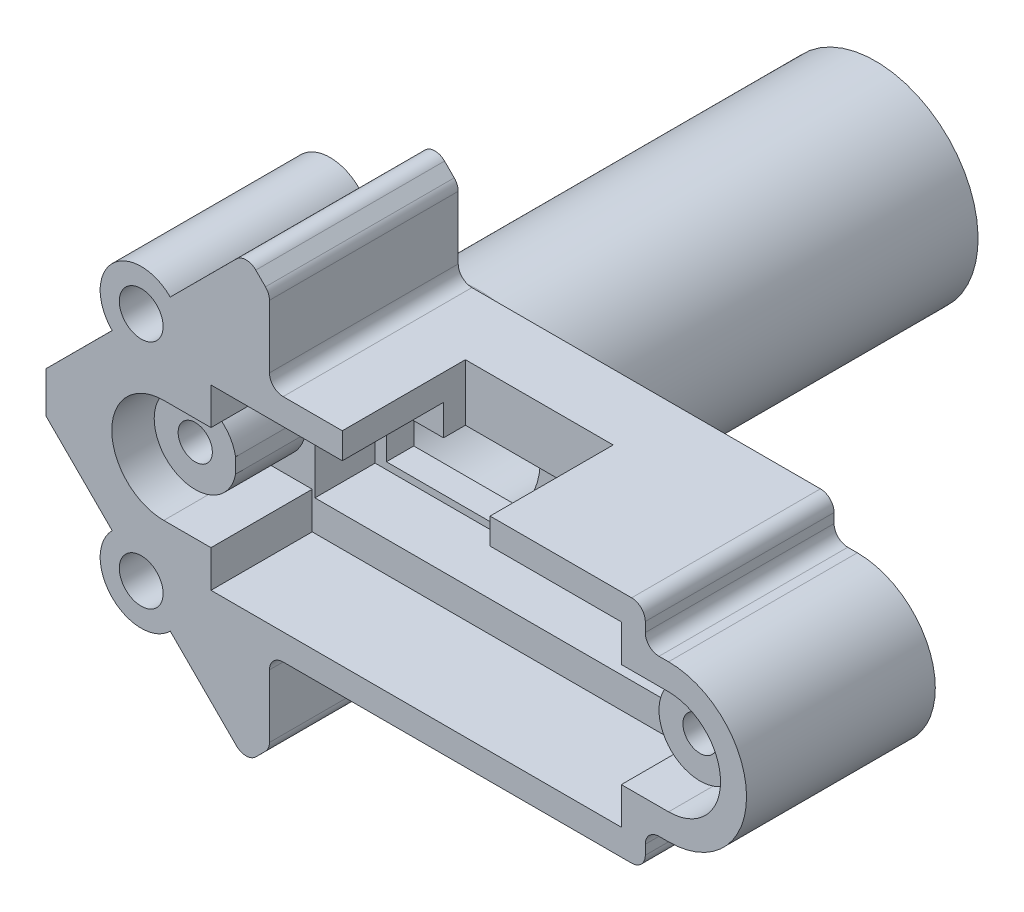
SolidWorks part; units mm, degrees
ref_plane "Ebene vorne" through (0, 0, 0) normal (0, 0, 1) x (1, 0, 0)
ref_plane "Ebene oben" through (0, 0, 0) normal (0, 1, 0) x (1, 0, 0)
ref_plane "Ebene rechts" through (0, 0, 0) normal (1, 0, 0) x (0, 0, -1)
sketch "Skizze1" plane through (0, 0, 0) normal (0, 0, 1) x (1, 0, 0)
  line L0 (0, 0) -> (36.9, 0) construction
  line L1 (0, 3.7) -> (3.7, 3.7) construction
  line L2 (3.7, -6.4) -> (33.2, -6.4) construction
  line L3 (3.7, -6.4) -> (3.7, -3.7) construction
  line L4 (3.7, 6.4) -> (33.2, 6.4) construction
  line L5 (33.2, -6.4) -> (33.2, -3.7) construction
  line L6 (3.7, -6.4) -> (33.2, 6.4) construction
  line L7 (3.7, 6.4) -> (33.2, -6.4) construction
  line L8 (0, -3.7) -> (3.7, -3.7) construction
  line L9 (36.9, 3.7) -> (33.2, 3.7) construction
  line L10 (36.9, -3.7) -> (33.2, -3.7) construction
  line L11 (33.2, 3.7) -> (33.2, 6.4) construction
  line L12 (3.7, 3.7) -> (3.7, 6.4) construction
  line L13 (0, 5.7) -> (1.7, 5.7)
  line L14 (1.7, 5.7) -> (1.7, 8.4)
  line L15 (1.7, 8.4) -> (35.2, 8.4)
  line L16 (35.2, 5.7) -> (35.2, 8.4)
  line L17 (36.9, 5.7) -> (35.2, 5.7)
  line L18 (36.9, -5.7) -> (35.2, -5.7)
  line L19 (35.2, -8.4) -> (35.2, -5.7)
  line L20 (1.7, -8.4) -> (35.2, -8.4)
  line L21 (1.7, -8.4) -> (1.7, -5.7)
  line L22 (0, -5.7) -> (1.7, -5.7)
  arc A0 (0, 3.7) -> (0, -3.7) centre (0, 0) ccw construction
  arc A1 (36.9, -3.7) -> (36.9, 3.7) centre (36.9, 0) ccw construction
  arc A2 (36.9, -5.7) -> (36.9, 5.7) centre (36.9, 0) ccw
  arc A3 (0, 5.7) -> (0, -5.7) centre (0, 0) ccw
  point P5 (18.45, 0)
  dimension "D1" = 7.4
  dimension "D2" = 7.4
  dimension "D3" = 36.9
  dimension "D4" = 12.8
  dimension "D5" = 29.5
  dimension "D6" = 2
extrude "Aufsatz-Linear austragen1" add sketch "Skizze1" along normal blind 13.8
sketch "Skizze2" plane through (0, 0, 13.8) normal (0, 0, 1) x (1, 0, 0)
  line L0 (1.7, 8.4) -> (35.2, -8.4) construction
  line L2 (4.475, -3.75) -> (32.425, -3.75)
  line L3 (4.475, -3.75) -> (4.475, 3.75)
  line L4 (4.475, 3.75) -> (32.425, 3.75)
  line L5 (32.425, -3.75) -> (32.425, 3.75)
  line L6 (4.475, -3.75) -> (32.425, 3.75) construction
  line L7 (4.475, 3.75) -> (32.425, -3.75) construction
  point P4 (18.45, 0)
  dimension "D1" = 7.5
  dimension "D2" = 27.95
extrude "Schnitt-Linear austragen1" cut sketch "Skizze2" against normal blind 18.3
sketch "Skizze3" plane through (0, 0, 13.8) normal (0, 0, 1) x (1, 0, 0)
  line L0 (1.7, 8.4) -> (35.2, -8.4) construction
  line L2 (3.65, -4.25) -> (33.25, -4.25)
  line L3 (3.65, -4.25) -> (3.65, 4.25)
  line L4 (3.65, 4.25) -> (33.25, 4.25)
  line L5 (33.25, -4.25) -> (33.25, 4.25)
  line L6 (3.65, -4.25) -> (33.25, 4.25) construction
  line L7 (3.65, 4.25) -> (33.25, -4.25) construction
  point P4 (18.45, 0)
  dimension "D1" = 8.5
  dimension "D2" = 29.6
extrude "Schnitt-Linear austragen2" cut sketch "Skizze3" against normal blind 11.8
sketch "Skizze5" plane through (0, 0, 13.8) normal (0, 0, 1) x (1, 0, 0)
  line L0 (0, 3.7) -> (3.7, 3.7)
  line L1 (3.7, 3.7) -> (3.7, 6.4)
  line L2 (3.7, 6.4) -> (33.2, 6.4)
  line L3 (33.2, 6.4) -> (33.2, 3.7)
  line L4 (33.2, 3.7) -> (36.9, 3.7)
  line L5 (36.9, -3.7) -> (33.2, -3.7)
  line L6 (33.2, -3.7) -> (33.2, -6.4)
  line L7 (33.2, -6.4) -> (3.7, -6.4)
  line L8 (3.7, -6.4) -> (3.7, -3.7)
  line L9 (3.7, -3.7) -> (0, -3.7)
  arc A0 (0, 3.7) -> (0, -3.7) centre (0, 0) ccw
  arc A1 (36.9, -3.7) -> (36.9, 3.7) centre (36.9, 0) ccw
extrude "Schnitt-Linear austragen4" cut sketch "Skizze5" against normal blind 7.4
sketch "Skizze6" plane through (0, 0, 6.4) normal (0, 0, 1) x (1, 0, 0)
  circle A0 centre (0, 0) radius 3
  circle A1 centre (36.9, 0) radius 3
  dimension "D1" = 6
  dimension "D2" = 6
extrude "Aufsatz-Linear austragen2" add sketch "Skizze6" along normal blind 5.1
sketch "Skizze7" plane through (0, 0, 11.5) normal (0, 0, 1) x (1, 0, 0)
  circle A0 centre (0, 0) radius 1.25
  circle A1 centre (36.9, 0) radius 1.25
  dimension "D1" = 2.5
  dimension "D2" = 2.5
extrude "Schnitt-Linear austragen5" cut sketch "Skizze7" against normal blind 10
sketch "Skizze8" plane through (0, 8.4, 0) normal (0, 1, 0) x (1, 0, 0)
  line L0 (18.45, 0) -> (18.45, -13.8) construction
  line L1 (35.2, 0) -> (1.7, 0) construction
  line L2 (35.2, -13.8) -> (1.7, -13.8) construction
  line L4 (13.05, -13.8) -> (23.85, -13.8)
  line L5 (13.05, -13.8) -> (13.05, -4.8)
  line L6 (13.05, -4.8) -> (23.85, -4.8)
  line L7 (23.85, -13.8) -> (23.85, -4.8)
  point P10 (18.45, -4.8)
  dimension "D1" = 9
  dimension "D2" = 10.8
extrude "Schnitt-Linear austragen6" cut sketch "Skizze8" against normal blind 5
sketch "Skizze9" plane through (0, 0, 13.8) normal (0, 0, 1) x (1, 0, 0)
  line L0 (42.6, 0) -> (-19.4301, 0) construction
  line L1 (-1.65, 8.455) -> (-1.65, -8.455) construction
  line L2 (-8.61, 1.5) -> (-8.61, -1.5)
  line L3 (-8.61, 1.5) -> (-3.7721, 6.3344)
  line L4 (6.7251, 15.4104) -> (7.4319, 14.703)
  line L5 (7.4314, 13.2888) -> (1.7, 7.5615)
  line L6 (6.7251, -15.4104) -> (7.4319, -14.703)
  line L7 (7.4314, -13.2888) -> (1.7, -7.5615)
  line L8 (-8.61, -1.5) -> (-3.7721, -6.3344)
  line L9 (1.7, -5.7) -> (1.7, -7.5615)
  line L10 (1.7, -5.7) -> (1.7, -8.4) construction
  line L11 (1.7, -5.7) -> (-0.3, -5.5629)
  line L12 (0.4721, -10.5756) -> (5.3109, -15.4109)
  line L13 (-0.3, -5.5629) -> (-3.7433, -2.1221)
  line L14 (0.4721, 10.5756) -> (5.3109, 15.4109)
  line L15 (1.7, 7.5615) -> (1.7, 5.7)
  line L16 (1.7, 8.4) -> (1.7, 5.7) construction
  line L17 (1.7, 5.7) -> (-0.3, 5.5629)
  line L18 (-0.3, 5.5629) -> (-3.7433, 2.1221)
  arc A0 (36.9, -5.7) -> (36.9, 5.7) centre (36.9, 0) ccw construction
  circle A1 centre (-1.65, 8.455) radius 1.6
  circle A2 centre (-1.65, -8.455) radius 1.6
  circle A3 centre (0, 0) radius 1.25 construction
  arc A4 (7.4319, 14.703) -> (7.4314, 13.2888) centre (6.7246, 13.9961) cw
  arc A5 (5.3109, 15.4109) -> (6.7251, 15.4104) centre (6.0177, 14.7035) cw
  arc A6 (7.4319, -14.703) -> (7.4314, -13.2888) centre (6.7246, -13.9961) ccw
  arc A7 (5.3109, -15.4109) -> (6.7251, -15.4104) centre (6.0177, -14.7035) ccw
  arc A8 (-3.7433, 2.1221) -> (-3.7433, -2.1221) centre (-1.6227, 0) ccw
  arc A10 (-3.7721, -6.3344) -> (0.4721, -10.5756) centre (-1.65, -8.455) ccw
  arc A11 (0.4721, 10.5756) -> (-3.7721, 6.3344) centre (-1.65, 8.455) ccw
  point P11 (-1.65, 0)
  point P17 (-8.61, 0)
  point P22 (8.1388, 13.9956)
  point P25 (6.0182, 16.1177)
  point P34 (-5.8669, 0)
  dimension "D2" = 3.2
  dimension "D3" = 3.2
  dimension "D4" = 1.65
  dimension "D9" = 1
  dimension "D10" = 3
  dimension "D11" = 3
  dimension "D12" = 6
  dimension "D1" = 16.91
  dimension "D5" = 3
  dimension "D6" = 6.96
  dimension "D7" = 20.68
  dimension "D8" = 3
  dimension "D13" = 2
  dimension "D14" = 2
extrude "Aufsatz-Linear austragen3" add sketch "Skizze9" against normal up to surface (13.8 mm away) contours A1 | A2 | L2 L8 A10 L12 A7 L6 A6 L7 L9 L11 L13 A8 L18 L17 L15 L5 A4 L4 A5 L14 A11 L3
sketch "Skizze10" plane through (0, 0, 13.8) normal (0, 0, 1) x (1, 0, 0)
  line L0 (7.7246, 13.9961) -> (7.7246, 8.4)
  line L2 (13.05, 8.4) -> (2.5391, 8.4) construction
  line L3 (7.7246, 8.4) -> (2.5391, 8.4)
  line L4 (2.5391, 8.4) -> (7.7246, 13.9961)
  line L5 (-8.61, 0) -> (42.6, 0) construction
  line L6 (-8.61, 1.5) -> (-8.61, -1.5) construction
  line L7 (7.7246, -8.4) -> (2.5391, -8.4)
  line L8 (7.7246, -13.9961) -> (7.7246, -8.4)
  line L9 (2.5391, -8.4) -> (7.7246, -13.9961)
  arc A1 (7.4314, 13.2888) -> (7.4319, 14.703) centre (6.7246, 13.9961) ccw construction
  arc A2 (36.9, -5.7) -> (36.9, 5.7) centre (36.9, 0) ccw construction
extrude "Aufsatz-Linear austragen4" add sketch "Skizze10" against normal up to surface (13.8 mm away) contours L0 M34 M33 M32 | L4 M33 M34 | L7 L9 L8
fillet "Verrundung1" radius 1 6 edges at (7.7246, -8.4, 6.9) (35.2, -8.4, 6.9) (35.2, -5.7, 6.9) (35.2, 5.7, 6.9) (35.2, 8.4, 6.9) (7.7246, 8.4, 6.9)
sketch "Skizze11" plane through (0, 0, 13.8) normal (0, 0, 1) x (1, 0, 0)
  line L0 (3.7, -6.4) -> (33.2, -6.4) construction
  line L1 (3.7, 6.4) -> (3.65, 6.4)
  line L2 (3.7, 6.4) -> (3.7, -6.4)
  line L3 (3.7, -6.4) -> (3.65, -6.4)
  line L4 (3.65, 6.4) -> (3.65, -6.4)
  line L5 (3.65, -3.7) -> (3.65, 3.7) construction
  line L6 (33.25, -4.25) -> (33.25, -3.7) construction
  line L7 (33.2, 6.4) -> (33.25, 6.4)
  line L8 (33.2, 6.4) -> (33.2, -6.4)
  line L9 (33.2, -6.4) -> (33.25, -6.4)
  line L10 (33.25, 6.4) -> (33.25, -6.4)
extrude "Schnitt-Linear austragen7" cut sketch "Skizze11" against normal up to surface (7.4 mm away)
sketch "Skizze14" plane through (0, 0, 13.8) normal (0, 0, 1) x (1, 0, 0)
  line L0 (0, 0) -> (36.9, 0) construction
  line L1 (18.45, -6.4) -> (18.45, 8.4) construction
  line L2 (3.65, -6.4) -> (33.25, -6.4) construction
  line L3 (23.85, 8.4) -> (13.05, 8.4) construction
  line L5 (33.45, -6.5) -> (3.45, -6.5)
  line L6 (33.45, -6.5) -> (33.45, 6.5)
  line L7 (33.45, 6.5) -> (3.45, 6.5)
  line L8 (3.45, -6.5) -> (3.45, 6.5)
  line L9 (33.45, -6.5) -> (3.45, 6.5) construction
  line L10 (33.45, 6.5) -> (3.45, -6.5) construction
  point P10 (18.45, 0)
  dimension "D1" = 30
  dimension "D2" = 13
extrude "Schnitt-Linear austragen8" cut sketch "Skizze14" against normal up to surface (7.4 mm away) contours L8 L6 L7 M7 M6 M5 M48 M47 M45 M44 M43 M42 M12 M11 M10 M9 | L8 L7 M9 M10 M11 M12 | L8 L5 L6 M47 M48 M5 M6 M7 | L6 L7 M42 M43 M44 M45
sketch "Skizze16" plane through (0, 0, 13.8) normal (0, 0, 1) x (1, 0, 0)
  line L0 (0, 3.8) -> (3.45, 3.8)
  line L1 (3.45, 6.5) -> (3.45, 3.7) construction
  line L2 (0, -3.8) -> (3.45, -3.8)
  line L3 (3.45, -3.7) -> (3.45, -6.5) construction
  line L4 (3.45, -3.8) -> (3.45, 3.8)
  line L5 (36.9, 3.8) -> (33.25, 3.8)
  line L6 (0, 3.3) -> (2.95, 3.3)
  line L7 (2.95, -3.3) -> (2.95, 3.3)
  line L8 (36.9, -3.8) -> (33.25, -3.8)
  line L9 (0, -3.3) -> (2.95, -3.3)
  line L10 (36.9, 3.3) -> (33.75, 3.3)
  line L11 (33.25, -3.8) -> (33.25, 3.8)
  line L12 (33.25, -4.25) -> (33.25, 4.25) construction
  line L13 (33.75, -3.3) -> (33.75, 3.3)
  line L14 (36.9, -3.3) -> (33.75, -3.3)
  arc A0 (0, 3.8) -> (0, -3.8) centre (0, 0) ccw
  arc A1 (36.9, -3.8) -> (36.9, 3.8) centre (36.9, 0) ccw
  arc A2 (0, 3.3) -> (0, -3.3) centre (0, 0) ccw
  arc A3 (36.9, -3.3) -> (36.9, 3.3) centre (36.9, 0) ccw
  dimension "D1" = 7.6
  dimension "D2" = 7.6
  dimension "D3" = 0.5
  dimension "D4" = 0.5
extrude "Schnitt-Linear austragen9" cut sketch "Skizze16" against normal up to surface (7.4 mm away) contours L4 A2 L6 L7 L9 M9 M11 M10 | L0 A0 L2 M8 M9 M10 M11 M12 | L11 L8 L5 A3 L14 L13 L10 M6 M5 M4 M3 M2 | L8 A1 L5 M2 M3 M4 M5 M6
sketch "Skizze17" plane through (0, 0, 0) normal (0, 0, -1) x (-1, 0, 0)
  line L0 (-4.475, 3.75) -> (-4.475, -3.75) construction
  line L1 (-32.425, 0) -> (-4.475, 0) construction
  line L2 (-32.425, -3.75) -> (-32.425, 3.75) construction
  line L3 (-8.225, 3.75) -> (-8.225, -3.75) construction
  line L4 (-32.425, 3.75) -> (-4.475, 3.75) construction
  line L5 (-4.475, -3.75) -> (-32.425, -3.75) construction
  circle A0 centre (-8.225, 0) radius 5.5
  circle A1 centre (-8.225, 0) radius 7.5
  dimension "D2" = 11
  dimension "D3" = 15
  dimension "D1" = 3.75
extrude "Aufsatz-Linear austragen5" add sketch "Skizze17" along normal blind 30
fillet "Verrundung2" radius 1 1 edges at (0.725, 0, 0)
